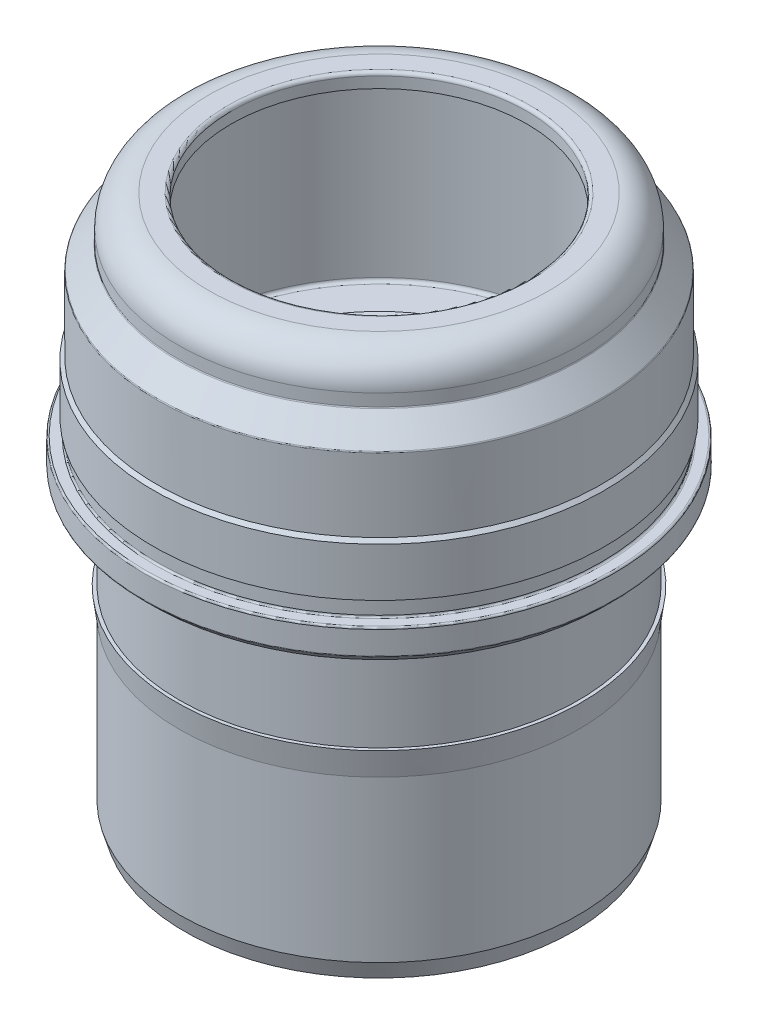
SolidWorks part; units mm, degrees
ref_plane "Plan de face" through (0, 0, 0) normal (0, 0, 1) x (1, 0, 0)
ref_plane "Plan de dessus" through (0, 0, 0) normal (0, 1, 0) x (1, 0, 0)
ref_plane "Plan de droite" through (0, 0, 0) normal (1, 0, 0) x (0, 0, -1)
sketch "Esquisse1" plane through (0, 0, 0) normal (0, 0, 1) x (1, 0, 0)
  line L0 (0, 0) -> (0, 21.6561) construction
  line L1 (8.675, 0) -> (11.5, 0)
  line L2 (11.8, 17.65) -> (11.8, 12)
  line L3 (11.8, 1) -> (11.5, 0)
  line L4 (11.8, 17.65) -> (13.4, 17.65)
  line L5 (13.4, 17.65) -> (13.9, 18.15)
  line L6 (13.9, 18.15) -> (13.9, 19.65)
  line L7 (13.15, 19.65) -> (13.15, 20.65)
  line L8 (13.35, 20.65) -> (13.35, 23.53)
  line L9 (13.9, 19.65) -> (13.15, 19.65)
  line L10 (13.35, 20.65) -> (13.15, 20.65)
  line L11 (13.35, 23.53) -> (13.15, 23.73)
  line L12 (13.15, 23.73) -> (13.15, 28.1)
  line L13 (13.15, 28.1) -> (11.9, 29.5)
  line L14 (11.9, 29.5) -> (11.9, 30.25)
  line L15 (10.05, 32.1) -> (8.75, 32.1)
  line L16 (11.8, 12) -> (12, 12)
  line L17 (12, 12) -> (11.8, 10.5)
  line L18 (11.8, 10.5) -> (11.8, 1)
  line L19 (8.675, 0) -> (8.675, 19.75)
  line L20 (8.75, 32.1) -> (8.75, 31.25)
  line L21 (8.75, 31.25) -> (10.05, 31.25)
  line L22 (11.05, 19.75) -> (11.05, 30.25)
  line L23 (8.675, 19.75) -> (11.05, 19.75)
  arc A0 (11.9, 30.25) -> (10.05, 32.1) centre (10.05, 30.25) ccw
  arc A1 (10.05, 31.25) -> (11.05, 30.25) centre (10.05, 30.25) cw
  point P26 (11.9, 32.1)
  dimension "D21" = 1.85
  dimension "D25" = 1
  dimension "D1" = 17.35
  dimension "D2" = 23.6
  dimension "D3" = 1
  dimension "D4" = 0.3
  dimension "D5" = 17.65
  dimension "D6" = 27.8
  dimension "D7" = 0.5
  dimension "D8" = 0.5
  dimension "D9" = 2
  dimension "D10" = 26.7
  dimension "D11" = 1
  dimension "D12" = 26.3
  dimension "D13" = 26.3
  dimension "D14" = 32.1
  dimension "D15" = 12
  dimension "D16" = 1.5
  dimension "D17" = 24
  dimension "D18" = 2.6
  dimension "D19" = 4
  dimension "D20" = 23.8
  dimension "D22" = 17.5
  dimension "D23" = 0.85
  dimension "D24" = 22.1
  dimension "D26" = 11.5
  dimension "D27" = 2.88
revolve "Révolution1" add sketch "Esquisse1" angle 360 about L0
fillet "Congé1" radius 0.2 2 edges at (0, 0, -8.675) (0, 32.1, -8.75)
chamfer "Chanfrein1" distance 0.2 angle 45 1 edges at (0, 19.75, -8.675)
fillet "Congé2" radius 0.2 1 edges at (0, 19.75, -11.05)
fillet "Congé3" radius 0.1 8 edges at (0, 28.1, -13.15) (0, 29.5, -11.9) (0, 17.65, -11.8) (0, 17.65, -13.4) (0, 19.65, -13.15) (0, 20.65, -13.15) (0, 18.15, -13.9) (0, 19.65, -13.9)
